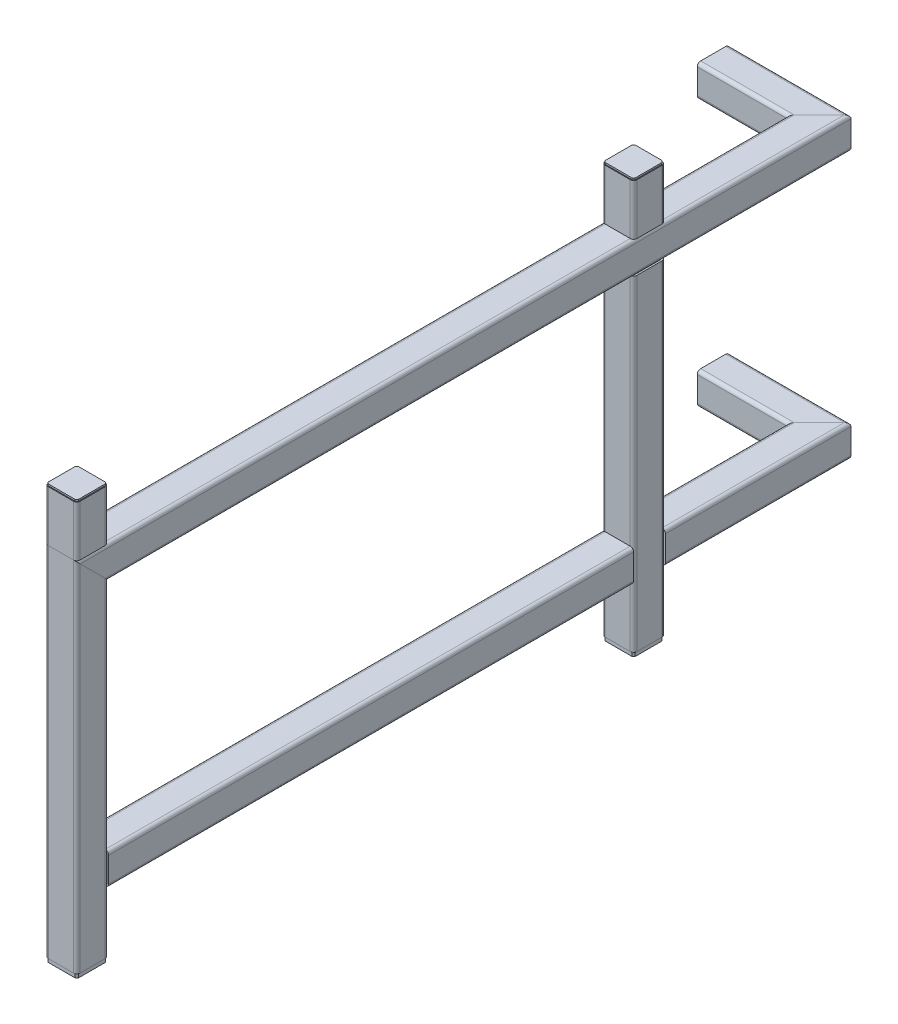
SolidWorks part; units mm, degrees
ref_plane "Plan de face" through (0, 0, 0) normal (0, 0, 1) x (1, 0, 0)
ref_plane "Plan de dessus" through (0, 0, 0) normal (0, 1, 0) x (1, 0, 0)
ref_plane "Plan de droite" through (0, 0, 0) normal (1, 0, 0) x (0, 0, -1)
sketch3d "Esquisse3D5"
  line L0 (0, 0, 0) -> (0, 652.5, 0)
  line L1 (0, 150, 0) -> (0, 150, -1050)
  line L2 (0, 652.5, -1050) -> (0, 0, -1050)
  line L3 (0, 150, -1050) -> (0, 150, -1400)
  line L4 (0, 150, -1400) -> (-200, 150, -1400)
  line L5 (0, 652.5, 0) -> (0, 652.5, -1400)
  line L6 (0, 652.5, -1400) -> (-200, 652.5, -1400)
  dimension "D1" = 652.5
  dimension "D2" = 1050
  dimension "D3" = 150
  dimension "D4" = 350
  dimension "D5" = 200
other "Elément mécano-soudé1"
ref_plane "Plan1" through (0, 0, 0) normal (0, 1, 0) x (1, 0, 0)
sketch "Sketch11" plane through (0, 0, 0) normal (0, 1, 0) x (1, 0, 0)
  line L0 (-23.6, -26.8) -> (23.6, -26.8)
  line L1 (-26.8, -23.6) -> (-26.8, 23.6)
  line L2 (23.6, 26.8) -> (-23.6, 26.8)
  line L3 (26.8, 23.6) -> (26.8, -23.6)
  line L4 (-23.6, -30) -> (23.6, -30)
  line L5 (-30, -23.6) -> (-30, 23.6)
  line L6 (23.6, 30) -> (-23.6, 30)
  line L7 (30, 23.6) -> (30, -23.6)
  line L8 (-30, 0) -> (-26.8, 0) construction
  line L9 (-26.8, 0) -> (26.8, 0) construction
  line L10 (26.8, 0) -> (30, 0) construction
  line L12 (0, 30) -> (0, 26.8) construction
  line L13 (0, 26.8) -> (0, -26.8) construction
  line L14 (0, -26.8) -> (0, -30) construction
  arc A0 (30, 23.6) -> (23.6, 30) centre (23.6, 23.6) ccw
  arc A1 (23.6, -30) -> (30, -23.6) centre (23.6, -23.6) ccw
  arc A2 (-30, -23.6) -> (-23.6, -30) centre (-23.6, -23.6) ccw
  arc A3 (-23.6, 30) -> (-30, 23.6) centre (-23.6, 23.6) ccw
  arc A4 (-23.6, 26.8) -> (-26.8, 23.6) centre (-23.6, 23.6) ccw
  arc A5 (26.8, 23.6) -> (23.6, 26.8) centre (23.6, 23.6) ccw
  arc A6 (23.6, -26.8) -> (26.8, -23.6) centre (23.6, -23.6) ccw
  arc A7 (-26.8, -23.6) -> (-23.6, -26.8) centre (-23.6, -23.6) ccw
  point P2 (-30, 30)
  point P33 (-30, -30)
  point P34 (30, -30)
  point P36 (30, 30)
  point P37 (0, 0)
  dimension "D1" = 6.4
  dimension "Thickness" = 3.2
  dimension "V_leg" = 60
  dimension "H_leg" = 60
other "Embout1" parameters "D1"=8, "D2"=3, "D3"=3
hole_wizard "Trou taraudé M121" positions "Esquisse3D6" profile "Esquisse2" tap size "M12" standard "ISO"
sketch3d "Esquisse3D6"
  point P0 (0, 0, 0)
sketch "Esquisse2" plane through (0, 0, 0) normal (1, 0, 0) x (0, 0, -1)
  line L0 (0, 0) -> (0, 8)
  line L1 (0, 8) -> (5.1, 8)
  line L2 (5.1, 8) -> (5.1, 0)
  line L5 (5.1, 0) -> (0, 0)
  line L11 (0, -6.35) -> (0, 107.95) construction
  dimension "Diamètre du trou pour taraudage jusqu'au prochain" = 10.2
  dimension "Profondeur du trou pour taraudage jusqu'au prochain" = 8
hole_wizard "Trou taraudé M122" positions "Esquisse3D7" profile "Esquisse3" tap size "M12" standard "ISO"
sketch3d "Esquisse3D7"
  point P0 (0, 0, -1050)
sketch "Esquisse3" plane through (0, 0, -1050) normal (1, 0, 0) x (0, 0, -1)
  line L0 (0, 0) -> (0, 8)
  line L1 (0, 8) -> (5.1, 8)
  line L2 (5.1, 8) -> (5.1, 0)
  line L5 (5.1, 0) -> (0, 0)
  line L11 (0, -6.35) -> (0, 107.95) construction
  dimension "Diamètre du trou pour taraudage jusqu'au prochain" = 10.2
  dimension "Profondeur du trou pour taraudage jusqu'au prochain" = 8
other "Ajuster/Prolonger1"
sketch "Esquisse4" plane through (0, 0, 0) normal (1, 0, 0) x (0, 0, -1)
  line L0 (0, 682.5) -> (0, 781.5)
  line L1 (1423.6, 682.5) -> (-30, 682.5) construction
  line L2 (1050, 682.5) -> (1050, 781.5)
  line L3 (1050, 652.5) -> (1050, 0) construction
  dimension "D1" = 99
other "Elément mécano-soudé2"
ref_plane "Plan2" through (0, 682.5, 0) normal (0, 1, 0) x (0, 0, 1)
sketch "Sketch1" plane through (0, 682.5, 0) normal (0, 1, 0) x (0, 0, 1)
  line L0 (-23.6, -26.8) -> (23.6, -26.8)
  line L1 (-26.8, -23.6) -> (-26.8, 23.6)
  line L2 (23.6, 26.8) -> (-23.6, 26.8)
  line L3 (26.8, 23.6) -> (26.8, -23.6)
  line L4 (-23.6, -30) -> (23.6, -30)
  line L5 (-30, -23.6) -> (-30, 23.6)
  line L6 (23.6, 30) -> (-23.6, 30)
  line L7 (30, 23.6) -> (30, -23.6)
  line L8 (-30, 0) -> (-26.8, 0) construction
  line L9 (-26.8, 0) -> (26.8, 0) construction
  line L10 (26.8, 0) -> (30, 0) construction
  line L12 (0, 30) -> (0, 26.8) construction
  line L13 (0, 26.8) -> (0, -26.8) construction
  line L14 (0, -26.8) -> (0, -30) construction
  arc A0 (30, 23.6) -> (23.6, 30) centre (23.6, 23.6) ccw
  arc A1 (23.6, -30) -> (30, -23.6) centre (23.6, -23.6) ccw
  arc A2 (-30, -23.6) -> (-23.6, -30) centre (-23.6, -23.6) ccw
  arc A3 (-23.6, 30) -> (-30, 23.6) centre (-23.6, 23.6) ccw
  arc A4 (-23.6, 26.8) -> (-26.8, 23.6) centre (-23.6, 23.6) ccw
  arc A5 (26.8, 23.6) -> (23.6, 26.8) centre (23.6, 23.6) ccw
  arc A6 (23.6, -26.8) -> (26.8, -23.6) centre (23.6, -23.6) ccw
  arc A7 (-26.8, -23.6) -> (-23.6, -26.8) centre (-23.6, -23.6) ccw
  point P2 (-30, 30)
  point P33 (-30, -30)
  point P34 (30, -30)
  point P36 (30, 30)
  point P37 (0, 0)
  dimension "D1" = 6.4
  dimension "Thickness" = 3.2
  dimension "V_leg" = 60
  dimension "H_leg" = 60
other "Embout2" parameters "D1"=3, "D2"=3, "D3"=3
